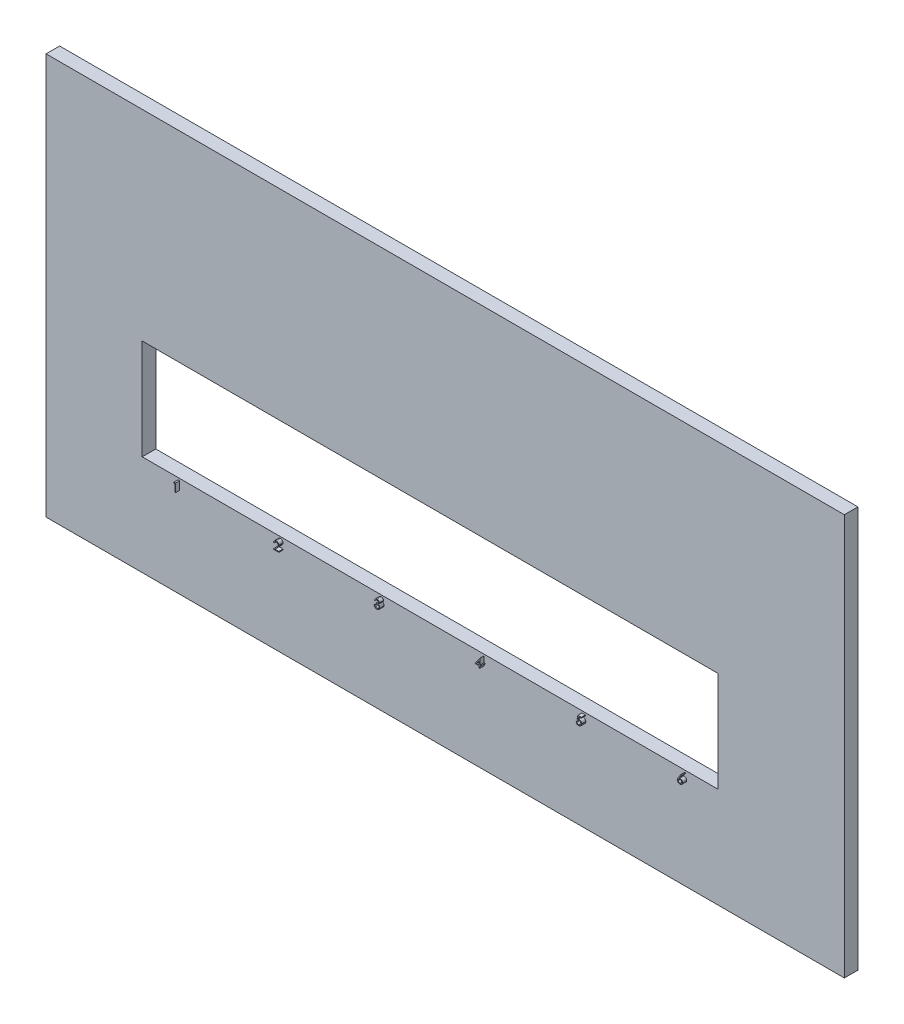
SolidWorks part; units mm, degrees
ref_plane "Front" through (0, 0, 0) normal (0, 0, 1) x (1, 0, 0)
ref_plane "Top" through (0, 0, 0) normal (0, 1, 0) x (1, 0, 0)
ref_plane "Right" through (0, 0, 0) normal (1, 0, 0) x (0, 0, -1)
sketch "Sketch1" plane through (0, 0, 0) normal (0, 0, 1) x (1, 0, 0)
  line L1 (0, 0) -> (4851.4, 0)
  line L2 (0, 0) -> (0, 2438.4)
  line L3 (0, 2438.4) -> (4851.4, 2438.4)
  line L4 (4851.4, 0) -> (4851.4, 2438.4)
  dimension "D1" = 4851.4
  dimension "D2" = 2438.4
extrude "Boss-Extrude1" add sketch "Sketch1" along normal blind 82.55
sketch "Sketch2" plane through (0, 0, 82.55) normal (0, 0, 1) x (1, 0, 0)
  line L0 (0, 2438.4) -> (0, 0) construction
  line L1 (584.2, 1219.2) -> (4083.05, 1219.2)
  line L2 (584.2, 1219.2) -> (584.2, 609.6)
  line L3 (584.2, 609.6) -> (4083.05, 609.6)
  line L4 (4083.05, 1219.2) -> (4083.05, 609.6)
  line L5 (0, 0) -> (4851.4, 0) construction
  dimension "D1" = 3498.85
  dimension "D2" = 584.2
  dimension "D3" = 609.6
  dimension "D4" = 609.6
extrude "Cut-Extrude1" cut sketch "Sketch2" against normal through all
sketch "Sketch3" plane through (0, 0, 82.55) normal (0, 0, 1) x (1, 0, 0)
  line L0 (576.9442, 547.3351) -> (4109.8714, 547.3351) construction
  text T0 "1   2   3   4   5   6" font "Century Gothic" height 50.8
extrude "Boss-Extrude2" add sketch "Sketch3" along normal blind 25.4
